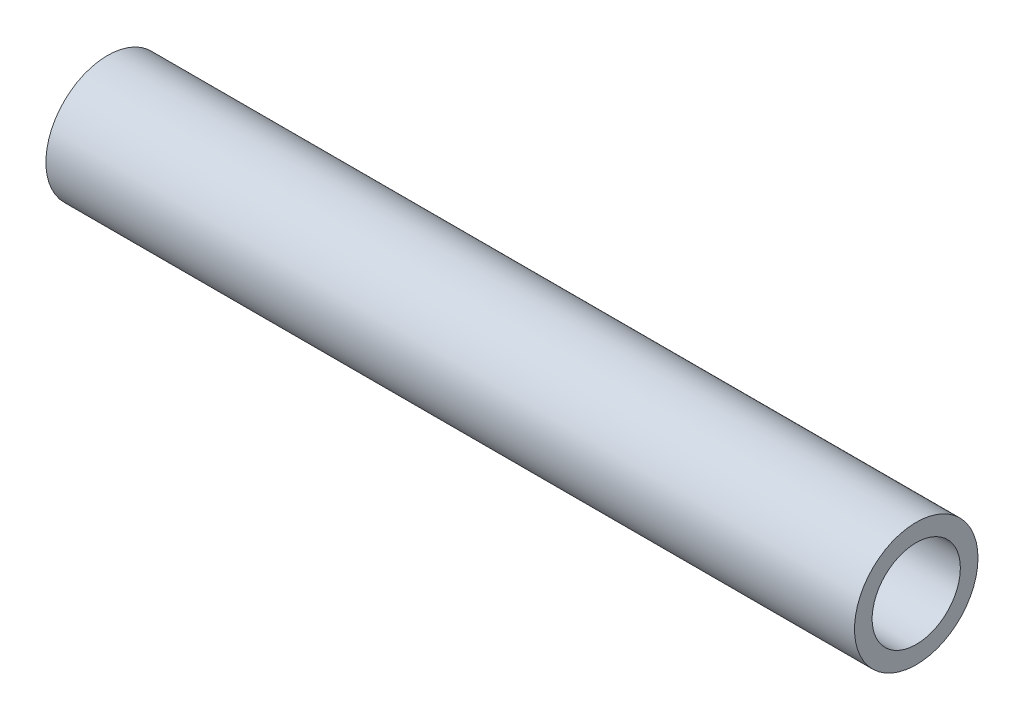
SolidWorks part; units mm, degrees
ref_plane "Front" through (0, 0, 0) normal (0, 0, 1) x (1, 0, 0)
ref_plane "Top" through (0, 0, 0) normal (0, 1, 0) x (1, 0, 0)
ref_plane "Right" through (0, 0, 0) normal (1, 0, 0) x (0, 0, -1)
sketch "Sketch1" plane through (0, 0, 0) normal (0, 0, 1) x (1, 0, 0)
  line L0 (0, 0) -> (139.7, 0)
  line L1 (9.9848, 0) -> (-9.9848, 0) construction
  dimension "D1" = 139.7
other "Structural Member1"
ref_plane "Plane1" through (0, 0, 0) normal (1, 0, 0) x (0, 0, -1)
sketch "Sketch11" plane through (0, 0, 0) normal (1, 0, 0) x (0, 0, -1)
  circle A0 centre (0, 0) radius 7.62
  circle A1 centre (0, 0) radius 10.668
  point P3 (0, 0)
  dimension "D1" = 21.336
  dimension "D2" = 15.24
